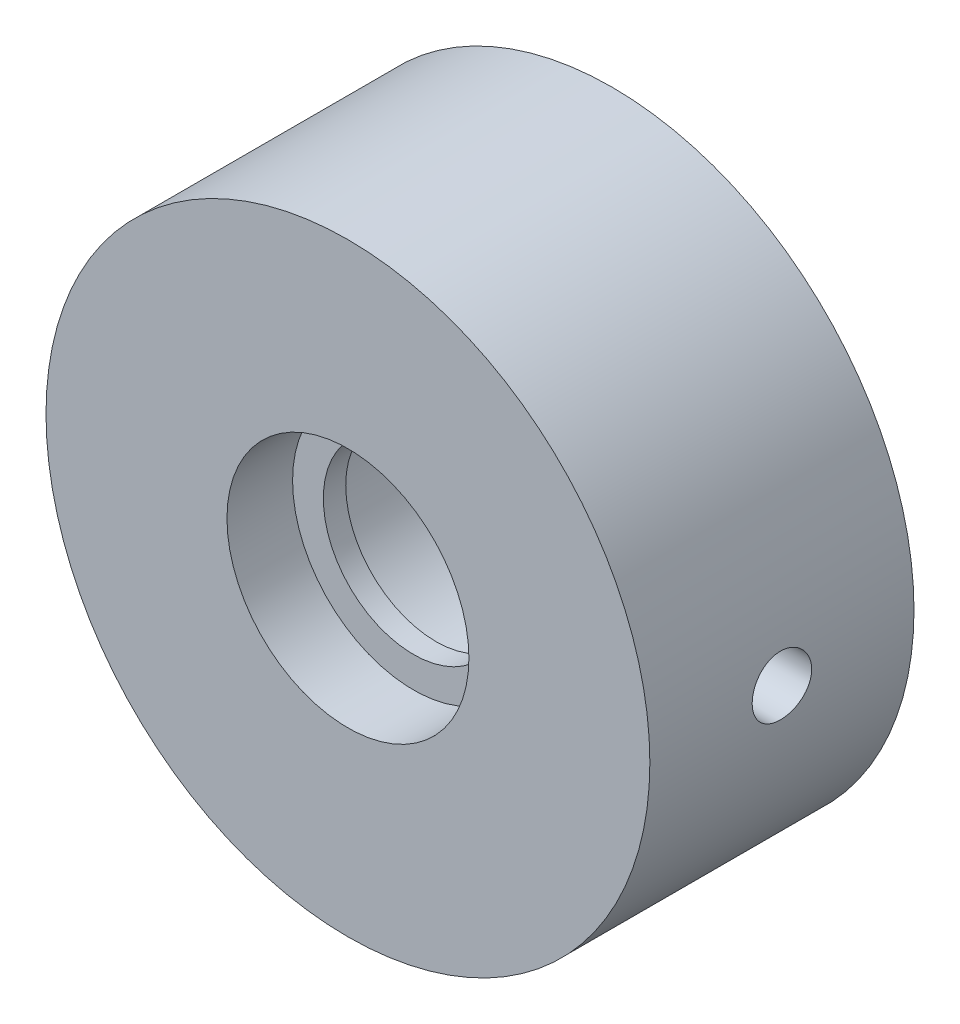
SolidWorks part; units mm, degrees
ref_plane "Front Plane" through (0, 0, 0) normal (0, 0, 1) x (1, 0, 0)
ref_plane "Top Plane" through (0, 0, 0) normal (0, 1, 0) x (1, 0, 0)
ref_plane "Right Plane" through (0, 0, 0) normal (1, 0, 0) x (0, 0, -1)
sketch "Sketch1" plane through (0, 0, 0) normal (0, 0, 1) x (1, 0, 0)
  circle A0 centre (0, 0) radius 29.95
  dimension "D1" = 59.9
extrude "Boss-Extrude1" add sketch "Sketch1" along normal blind 12.7
sketch "Sketch3" plane through (0, 0, 0) normal (0, 0, -1) x (-1, 0, 0)
  circle A0 centre (0, 0) radius 12
  dimension "D1" = 24
extrude "Cut-Extrude2" cut sketch "Sketch3" against normal through all
ref_plane "Plane1" through (0, 0, 3.9688) normal (0, 0, -1) x (-1, 0, 0)
sketch "Sketch4" plane through (0, 0, 3.9688) normal (0, 0, -1) x (-1, 0, 0)
  circle A1 centre (0, 0) radius 12
  dimension "D1" = 24
extrude "Boss-Extrude2" add sketch "Sketch4" against normal blind 2.2225
sketch "Sketch5" plane through (0, 0, 6.1913) normal (0, 0, 1) x (1, 0, 0)
  circle A0 centre (0, 0) radius 8.95
  dimension "D1" = 17.9
extrude "Cut-Extrude3" cut sketch "Sketch5" against normal through all
ref_point "Point1"
sketch "Sketch11" plane through (0, 0, 0) normal (0, 0, -1) x (-1, 0, 0)
  circle A0 centre (0, 0) radius 12 construction
  circle A1 centre (0, 0) radius 29.95 construction
  circle A2 centre (0, 0) radius 12
  circle A3 centre (0, 0) radius 29.95
extrude "Boss-Extrude6" add sketch "Sketch11" along normal blind 13.5
ref_plane "Plane2" through (-29.95, 0, 6.1913) normal (-1, 0, 0) x (0, 0, 1)
sketch "Sketch12" plane through (-29.95, 0, 6.1913) normal (-1, 0, 0) x (0, 0, 1)
  line L0 (-19.6913, 29.95) -> (-19.6913, -29.95) construction
  line L1 (6.5088, -29.95) -> (6.5088, 29.95) construction
  line L2 (-19.6913, 29.95) -> (-19.6913, -29.95) construction
  line L3 (6.5088, -29.95) -> (6.5088, 29.95) construction
  line L4 (6.5088, 0) -> (-19.6913, 0) construction
  line L5 (6.5088, 29.95) -> (-19.6913, 29.95) construction
  line L6 (-19.6913, -29.95) -> (6.5088, -29.95) construction
  line L7 (6.5088, 29.95) -> (-19.6913, 29.95) construction
  line L8 (-19.6913, -29.95) -> (6.5088, -29.95) construction
  line L9 (-6.5913, -29.95) -> (-6.5912, 29.95) construction
  circle A0 centre (-6.5912, 0) radius 2.95
  dimension "D1" = 5.9
extrude "Cut-Extrude4" cut sketch "Sketch12" against normal blind 9
mirror "Mirror2" about plane through (0, 0, 0) normal (1, 0, 0) of "Cut-Extrude4"
